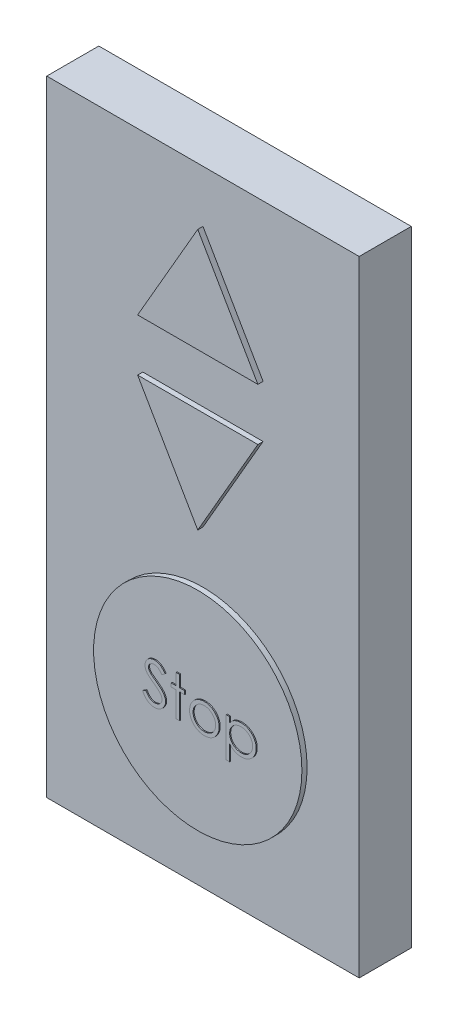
SolidWorks part; units mm, degrees
ref_plane "Front Plane" through (0, 0, 0) normal (0, 0, 1) x (1, 0, 0)
ref_plane "Top Plane" through (0, 0, 0) normal (0, 1, 0) x (1, 0, 0)
ref_plane "Right Plane" through (0, 0, 0) normal (1, 0, 0) x (0, 0, -1)
sketch "Sketch1" plane through (0, 0, 0) normal (0, 0, 1) x (1, 0, 0)
  line L1 (-41.8776, 29.1846) -> (34.3224, 29.1846)
  line L2 (-41.8776, 29.1846) -> (-41.8776, -123.2154)
  line L3 (-41.8776, -123.2154) -> (34.3224, -123.2154)
  line L4 (34.3224, 29.1846) -> (34.3224, -123.2154)
  dimension "D1" = 76.2
  dimension "D2" = 152.4
extrude "Boss-Extrude1" add sketch "Sketch1" along normal blind 12.7
sketch "Sketch2" plane through (0, 0, 12.7) normal (0, 0, 1) x (1, 0, 0)
  line L0 (-10.4136, -15.2654) -> (-1.9372, -15.2654)
  line L1 (-3.7776, 16.4846) -> (-18.4423, -8.9154)
  line L2 (-18.4423, -8.9154) -> (10.8871, -8.9154)
  line L3 (10.8871, -8.9154) -> (-3.7776, 16.4846)
  line L4 (-3.7776, -47.0154) -> (-18.4423, -21.6154)
  line L5 (10.8871, -21.6154) -> (-3.7776, -47.0154)
  line L6 (-18.4423, -21.6154) -> (10.8871, -21.6154)
  line L7 (34.3224, 29.1846) -> (-41.8776, 29.1846) construction
  line L8 (-3.7776, 29.1846) -> (-3.7776, 16.4846) construction
  circle A0 centre (-3.7776, -0.4487) radius 8.4667 construction
  circle A1 centre (-3.7776, -30.0821) radius 8.4667 construction
  dimension "D1" = 25.4
  dimension "D2" = 12.7
  dimension "D3" = 12.7
extrude "Boss-Extrude2" add sketch "Sketch2" along normal blind 1.27 contours L2 L3 L1 | L6 L4 L5
sketch "Sketch3" plane through (0, 0, 12.7) normal (0, 0, 1) x (1, 0, 0)
  line L0 (34.3224, -123.2154) -> (34.3224, 29.1846) construction
  line L1 (34.3224, 29.1846) -> (-41.8776, 29.1846) construction
  circle A0 centre (-3.7776, -85.1154) radius 25.4
  dimension "D1" = 50.8
  dimension "D2" = 38.1
  dimension "D3" = 114.3
extrude "Boss-Extrude3" add sketch "Sketch3" along normal blind 1.27
sketch "Sketch4" plane through (0, 0, 13.97) normal (0, 0, 1) x (1, 0, 0)
  text T0 "Stop  " font "Century Gothic" height in points 36
extrude "Boss-Extrude4" add sketch "Sketch4" along normal blind 0.254
